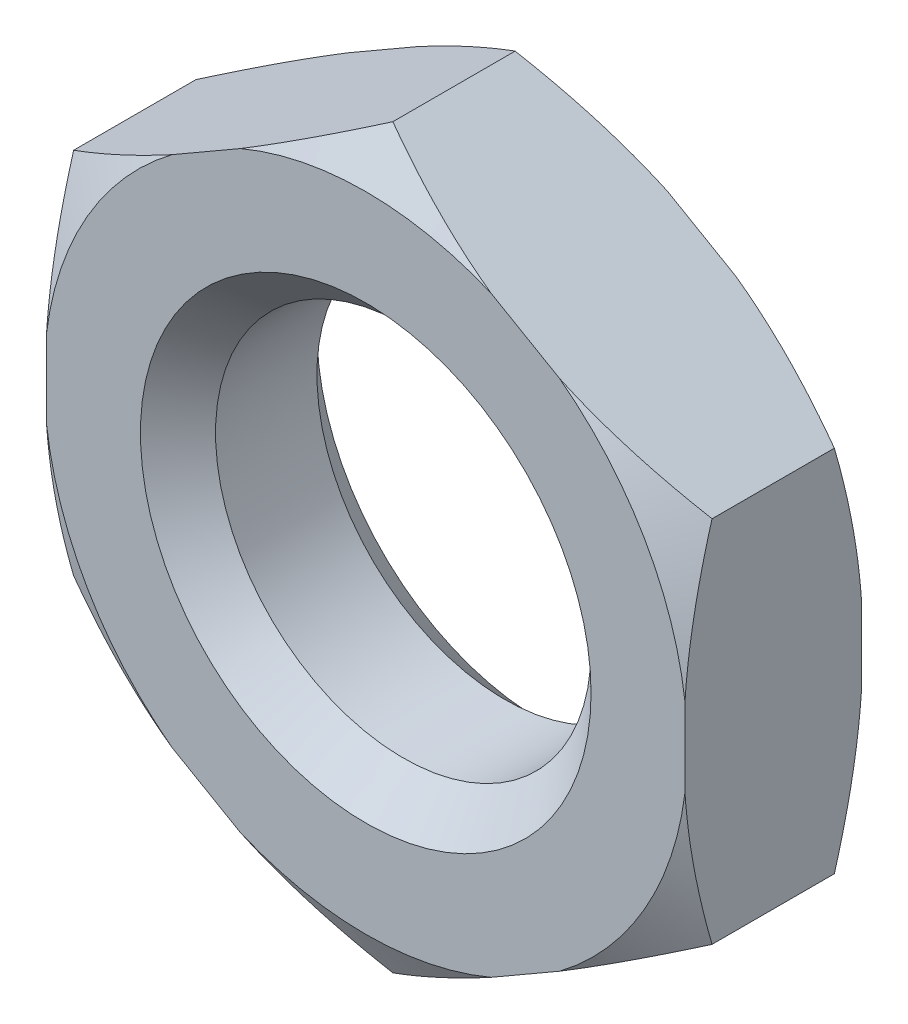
SolidWorks part; units mm, degrees
ref_plane "Front Plane" through (0, 0, 0) normal (0, 0, 1) x (1, 0, 0)
ref_plane "Top Plane" through (0, 0, 0) normal (0, 1, 0) x (1, 0, 0)
ref_plane "Right Plane" through (0, 0, 0) normal (1, 0, 0) x (0, 0, -1)
sketch "Sketch3" plane through (0, 0, 0) normal (0, 0, 1) x (1, 0, 0)
  line L1 (0, 9.815) -> (-8.5, 4.9075)
  line L2 (-8.5, 4.9075) -> (-8.5, -4.9075)
  line L3 (-8.5, -4.9075) -> (0, -9.815)
  line L4 (0, -9.815) -> (8.5, -4.9075)
  line L5 (8.5, -4.9075) -> (8.5, 4.9075)
  line L6 (8.5, 4.9075) -> (0, 9.815)
  circle A0 centre (0, 0) radius 8.5 construction
  dimension "D1" = 17
extrude "Boss-Extrude1" add sketch "Sketch3" along normal mid plane 4.7
sketch "Sketch4" plane through (0, 0, 0) normal (1, 0, 0) x (0, 0, -1)
  line L0 (-5.4578, 0) -> (6.1545, 0) construction
sketch "Sketch5" plane through (0, 0, 0) normal (1, 0, 0) x (0, 0, -1)
  line L0 (-2.35, 9.815) -> (-2.35, 8.565)
  line L1 (-2.35, 4.9075) -> (-2.35, 9.815) construction
  line L2 (-2.35, 8.565) -> (-1.6283, 9.815)
  line L3 (-2.35, 9.815) -> (2.35, 9.815) construction
  line L4 (-1.6283, 9.815) -> (-2.35, 9.815)
  dimension "D1" = 1.25
  dimension "D2" = 30
revolve "Cut-Revolve1" cut sketch "Sketch5" angle 360 about L0
mirror "Mirror1" about plane through (0, 0, 0) normal (0, 0, 1) of "Cut-Revolve1"
sketch "Sketch6" plane through (0, 0, 2.35) normal (0, 0, 1) x (1, 0, 0)
  circle A0 centre (0, 0) radius 5
  dimension "D1" = 10
extrude "Cut-Extrude1" cut sketch "Sketch6" against normal blind 4.7
chamfer "Chamfer1" distance 1 angle 45 2 edges at (5, 0, -2.35) (5, 0, 2.35)
